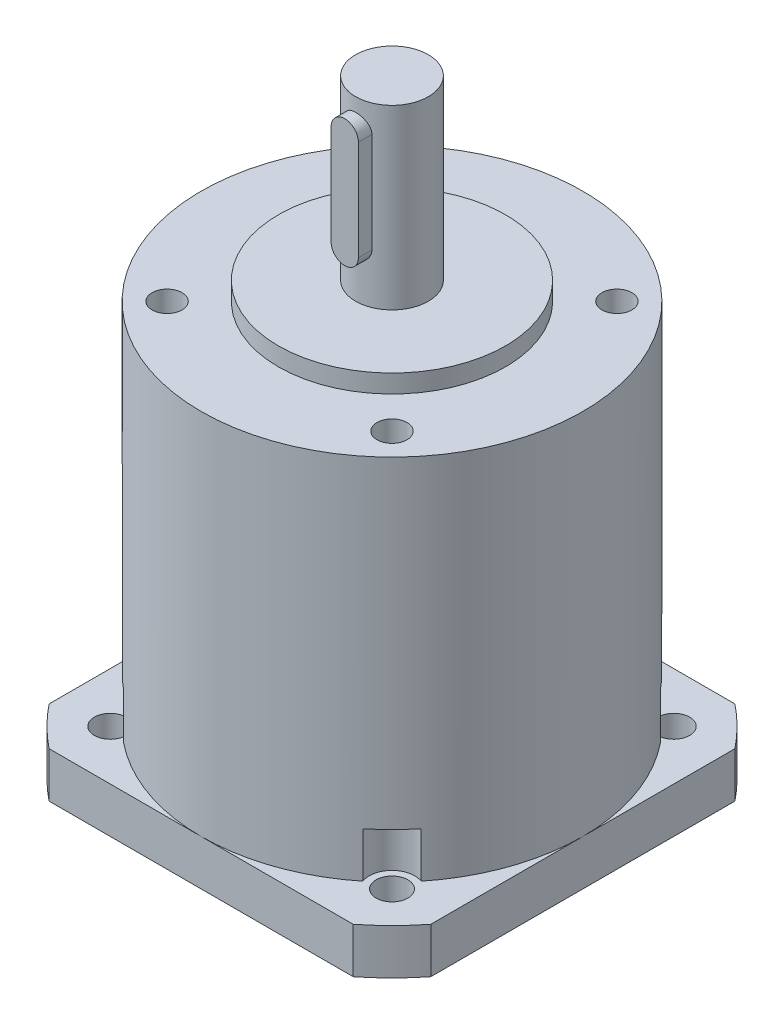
SolidWorks part; units mm, degrees
ref_plane "前视" through (0, 0, 0) normal (0, 0, 1) x (1, 0, 0)
ref_plane "上视" through (0, 0, 0) normal (0, 1, 0) x (1, 0, 0)
ref_plane "右视" through (0, 0, 0) normal (1, 0, 0) x (0, 0, -1)
sketch "草图1" plane through (0, 0, 0) normal (0, 1, 0) x (1, 0, 0)
  circle A0 centre (0, 0) radius 21
  dimension "D1" = 42
extrude "凸台-拉伸1" add sketch "草图1" along normal blind 40.5
ref_plane "基准面1" through (0, 40.5, 0) normal (0, 1, 0) x (1, 0, 0)
sketch "草图2" plane through (0, 40.5, 0) normal (0, 1, 0) x (1, 0, 0)
  circle A0 centre (0, 0) radius 12.5
  dimension "D1" = 25
extrude "凸台-拉伸2" add sketch "草图2" along normal blind 2
sketch "草图3" plane through (0, 40.5, 0) normal (0, 1, 0) x (1, 0, 0)
  circle A0 centre (0, 0) radius 4
  dimension "D1" = 8
extrude "凸台-拉伸3" add sketch "草图3" along normal blind 21.5
sketch "草图4" plane through (0, 40.5, 0) normal (0, 1, 0) x (1, 0, 0)
  point P4 (12.3744, -12.3744)
  point P5 (12.3744, 12.3744)
  point P6 (-12.3744, -12.3744)
  point P7 (-12.3744, 12.3744)
  point P8 (0, 0)
  dimension "D1" = 4
hole_wizard "M4 螺纹孔1" positions "草图6" profile "草图5" tap size "M4" standard "ISO"
sketch "草图6" plane through (0, 40.5, 0) normal (0, 1, 0) x (1, 0, 0)
  point P0 (-12.3744, 12.3744)
  point P3 (-12.3744, -12.3744)
  point P6 (12.3744, -12.3744)
  point P9 (12.3744, 12.3744)
sketch "草图5" plane through (-12.3744, 40.5, -12.3744) normal (1, 0, 0) x (0, 0, 1)
  line L0 (0, 0) -> (0, 9.9914)
  line L1 (0, 9.9914) -> (1.65, 9)
  line L2 (1.65, 9) -> (1.65, 0)
  line L5 (1.65, 0) -> (0, 0)
  line L10 (0, 9.9914) -> (-1.65, 9) construction
  line L11 (0, -6.35) -> (0, 107.95) construction
  dimension "螺纹孔钻头直径" = 3.3
  dimension "螺纹孔钻头深度" = 9
  dimension "导头角度" = 118
ref_plane "基准面2" through (0, 0, 2.2) normal (0, 0, 1) x (1, 0, 0)
sketch "草图7" plane through (0, 0, 2.2) normal (0, 0, 1) x (1, 0, 0)
  line L3 (-1.5, 59) -> (-1.5, 48)
  line L5 (1.5, 59) -> (1.5, 48)
  line L6 (-1.5, 59) -> (1.5, 48) construction
  line L7 (-1.5, 48) -> (1.5, 59) construction
  arc A0 (-1.5, 59) -> (1.5, 59) centre (0, 59) cw
  arc A1 (-1.5, 48) -> (1.5, 48) centre (0, 48) ccw
  point P0 (0, 53.5)
  dimension "D1" = 1.5
  dimension "D2" = 1.5
extrude "凸台-拉伸4" add sketch "草图7" along normal blind 3
sketch "草图8" plane through (0, 0, 0) normal (0, 1, 0) x (1, 0, 0)
  line L1 (-21, -21) -> (21, -21)
  line L2 (-21, -21) -> (-21, 21)
  line L3 (-21, 21) -> (21, 21)
  line L4 (21, -21) -> (21, 21)
  line L5 (-21, -21) -> (21, 21) construction
  line L6 (-21, 21) -> (21, -21) construction
  point P0 (0, 0)
extrude "凸台-拉伸5" add sketch "草图8" against normal blind 5
sketch "草图10" plane through (0, 0, 0) normal (0, 1, 0) x (1, 0, 0)
  circle A0 centre (0, 0) radius 26.85
  circle A1 centre (0, 0) radius 30.2655
  dimension "D1" = 53.7
  dimension "D2" = 60.5311
extrude "切除-拉伸2" cut sketch "草图10" against normal blind 5.5
ref_plane "基准面3" through (0, -5, 0) normal (0, -1, 0) x (-1, 0, 0)
sketch "草图11" plane through (0, -5, 0) normal (0, -1, 0) x (-1, 0, 0)
  circle A0 centre (0, 0) radius 11
  dimension "D1" = 22
extrude "切除-拉伸3" cut sketch "草图11" against normal blind 2.5
sketch "草图12" plane through (0, -5, 0) normal (0, -1, 0) x (-1, 0, 0)
  circle A0 centre (0, 0) radius 2.5
  dimension "D1" = 5
extrude "切除-拉伸4" cut sketch "草图12" against normal blind 10
sketch "草图13" plane through (0, -5, 0) normal (0, -1, 0) x (-1, 0, 0)
  circle A0 centre (-15.5, -15.5) radius 1.75
  circle A1 centre (-15.5, 15.5) radius 1.75
  circle A2 centre (15.5, 15.5) radius 1.75
  circle A3 centre (15.5, -15.5) radius 1.75
  point P12 (0, 0)
  dimension "D1" = 3.5
  dimension "D2" = 4
extrude "切除-拉伸5" cut sketch "草图13" against normal blind 10
sketch "草图14" plane through (0, 0, 0) normal (0, 1, 0) x (1, 0, 0)
  circle A0 centre (15.5, -15.5) radius 2.5
  circle A1 centre (-15.5, -15.5) radius 2.5
  circle A2 centre (-15.5, 15.5) radius 2.5
  circle A3 centre (15.5, 15.5) radius 2.5
  point P12 (0, 0)
  dimension "D1" = 5
  dimension "D2" = 4
extrude "切除-拉伸6" cut sketch "草图14" along normal blind 5
